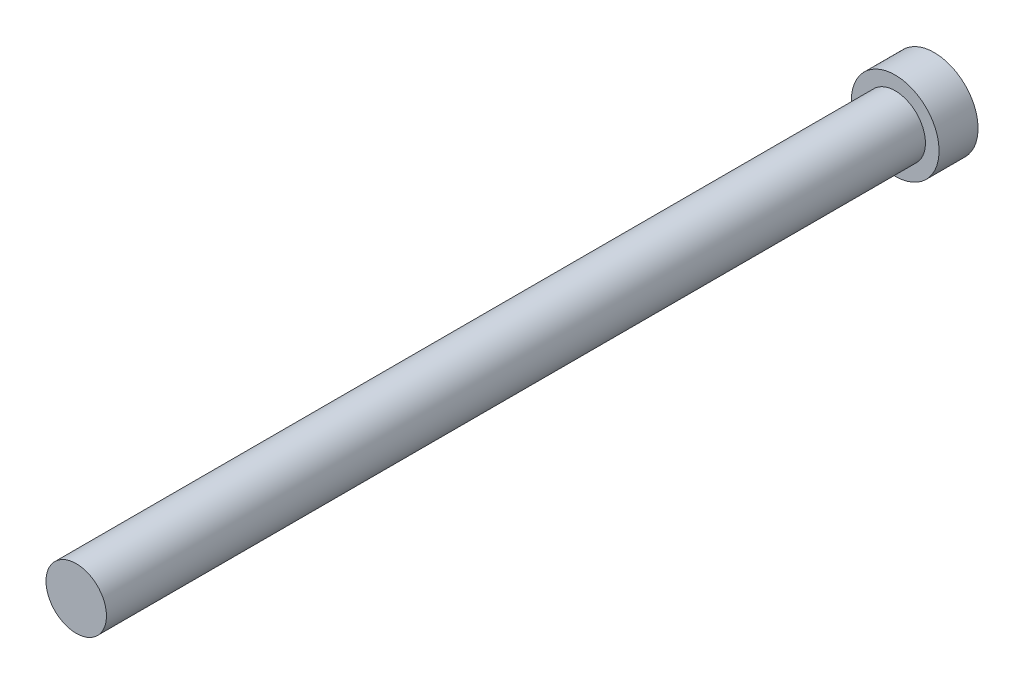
SolidWorks part; units mm, degrees
ref_plane "Frontal" through (0, 0, 0) normal (0, 0, 1) x (1, 0, 0)
ref_plane "Horizontal" through (0, 0, 0) normal (0, 1, 0) x (1, 0, 0)
ref_plane "Profil" through (0, 0, 0) normal (1, 0, 0) x (0, 0, -1)
sketch "Esquisse1" plane through (0, 0, 0) normal (0, 0, 1) x (1, 0, 0)
  circle A0 centre (0, 0) radius 3.1
  dimension "D1" = 6.2
extrude "Base-Extrusion" add sketch "Esquisse1" along normal blind 88
sketch "Esquisse2" plane through (0, 0, 0) normal (0, 0, -1) x (-1, 0, 0)
  circle A0 centre (0, 0) radius 4.5
  dimension "D1" = 9
extrude "Boss.-Extru.1" add sketch "Esquisse2" against normal blind 4
